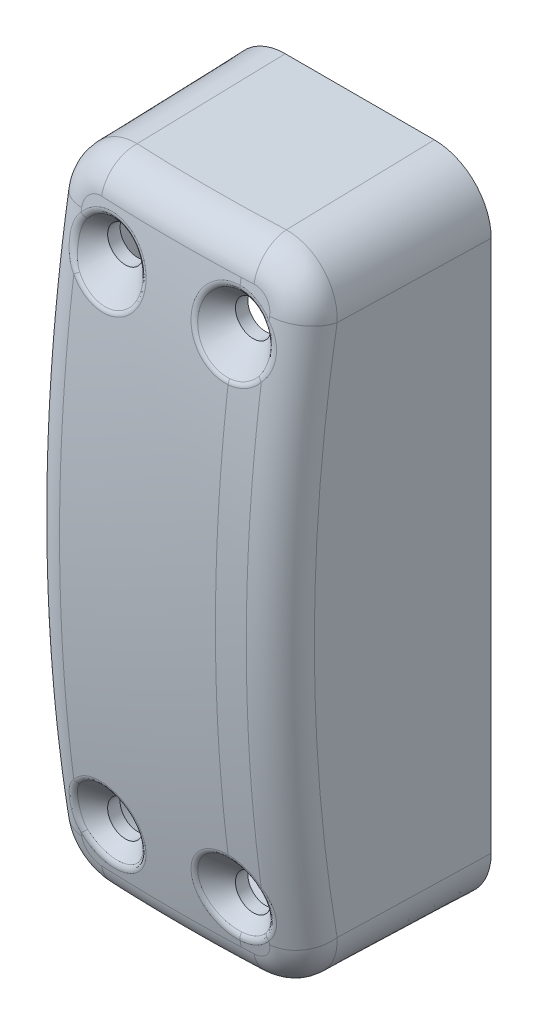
SolidWorks part; units mm, degrees
ref_plane "Plan de face" through (0, 0, 0) normal (0, 0, 1) x (1, 0, 0)
ref_plane "Plan de dessus" through (0, 0, 0) normal (0, 1, 0) x (1, 0, 0)
ref_plane "Plan de droite" through (0, 0, 0) normal (1, 0, 0) x (0, 0, -1)
sketch "Esquisse1" plane through (0, 0, 0) normal (0, 0, 1) x (1, 0, 0)
  line L0 (-18.5, 45.5) -> (18.5, -45.5) construction
  line L1 (-10.5, 45.5) -> (10.5, 45.5)
  line L2 (-18.5, 37.5) -> (-18.5, -37.5)
  line L3 (-10.5, -45.5) -> (10.5, -45.5)
  line L4 (18.5, 37.5) -> (18.5, -37.5)
  arc A0 (-18.5, -37.5) -> (-10.5, -45.5) centre (-10.5, -37.5) ccw
  arc A1 (10.5, -45.5) -> (18.5, -37.5) centre (10.5, -37.5) ccw
  arc A2 (10.5, 45.5) -> (18.5, 37.5) centre (10.5, 37.5) cw
  arc A3 (-10.5, 45.5) -> (-18.5, 37.5) centre (-10.5, 37.5) ccw
  dimension "D3" = 8
  dimension "D1" = 37
  dimension "D2" = 91
extrude "Boss.-Extru.1" add sketch "Esquisse1" along normal blind 35 draft 1.5
sketch "Esquisse2" plane through (0, 0, 0) normal (1, 0, 0) x (0, 0, -1)
  line L0 (0, 0) -> (-29.5, 0) construction
  line L2 (0, 45.5) -> (-25, 45.5) construction
  line L3 (0, -45.5) -> (-25, -45.5) construction
  line L4 (-17.0584, 75) -> (-37.1818, 75)
  line L5 (-37.1818, 75) -> (-37.1818, 0)
  line L6 (-37.1818, 0) -> (-29.5, 0)
  line L7 (0, 37.5) -> (0, -37.5) construction
  arc A0 (-25, 45.5) -> (-29.5, 0) centre (202.7778, 0) ccw
  arc A1 (-25, 45.5) -> (-17.0584, 75) centre (202.7778, 0) cw
  dimension "D4" = 29.5
  dimension "D1" = 25
  dimension "D2" = 7.6818
  dimension "D3" = 150
revolve "Enlèvement de matière-Révolution1" cut sketch "Esquisse2" angle 360 about L0
ref_plane "Plan1" through (0, 0, 28) normal (0, 0, -1) x (-1, 0, 0)
fillet "Congé3" radius 5 8 edges at (-15.0183, -43.2935, 24.935) (0, -44.8419, 25.1305) (16.2155, -42.1106, 25.0746) (17.7453, 0, 28.8212) (15.0183, 43.2935, 24.935) (0, 44.8419, 25.1305) (-16.2155, 42.1106, 25.0746) (-17.7453, 0, 28.8212)
ref_plane "Plan2" through (9, 0, 0) normal (1, 0, 0) x (0, 0, -1)
sketch "Esquisse4" plane through (9, 0, 0) normal (1, 0, 0) x (0, 0, -1)
  line L0 (-33.1168, 35) -> (9.8789, 35) construction
  dimension "D1" = 35
sketch "Esquisse5" plane through (9, 0, 0) normal (1, 0, 0) x (0, 0, -1)
  line L0 (0, 35) -> (-35.6546, 35) construction
  line L1 (0, -37.5) -> (0, 37.5) construction
  line L2 (-32.6299, 23.8768) -> (-24.0068, 32.5)
  line L3 (-24.0068, 32.5) -> (-24.0068, 35)
  line L4 (-24.0068, 35) -> (-32.6299, 35)
  line L6 (-32.6299, 35) -> (-32.6299, 23.8768)
  arc A0 (-25.7056, 40.8329) -> (-25.7056, -40.8329) centre (202.7778, 0) ccw construction
  arc A1 (-25.7056, 40.8329) -> (-25.7056, -40.8329) centre (202.7778, 0) ccw construction
  point P10 (-27.5068, 29)
  dimension "D1" = 35
  dimension "D2" = 45
  dimension "D3" = 5
  dimension "D4" = 12
  dimension "D5" = 8.6232
revolve "Enlèvement de matière-Révolution2" cut sketch "Esquisse5" angle 360 about L0
mirror "Symétrie1" about plane through (0, 0, 0) normal (1, 0, 0) of "Enlèvement de matière-Révolution2"
mirror "Symétrie2" about plane through (0, 0, 0) normal (0, 1, 0) of "Symétrie1", "Enlèvement de matière-Révolution2"
fillet "Congé4" radius 1 12 edges at (3.6366, -34.5233, 26.8913) (10.663, -39.1053, 25.9361) (10.9848, -29.4961, 27.3576) (3.6383, 33.8332, 26.9939) (10.7379, 29.3863, 27.3833) (10.8728, 39.0193, 25.9409) (-3.6275, -34.0736, 26.9586) (-3.6262, 34.1641, 26.9452) (13.8928, -34.8701, 26.4013) (-13.9161, -33.9427, 26.5353) (13.9161, 33.9427, 26.5353) (-13.8928, 34.8701, 26.4013)
shell "Coque1" thickness 1.75
sketch "Esquisse6" plane through (0, 0, 0) normal (0, 0, 1) x (1, 0, 0)
  circle A0 centre (-9, 35) radius 2.5 construction
  circle A1 centre (9, 35) radius 2.5 construction
  circle A2 centre (-9, -35) radius 2.5 construction
  circle A3 centre (9, -35) radius 2.5 construction
  circle A4 centre (-9, 35) radius 2.5
  circle A5 centre (9, 35) radius 2.5
  circle A6 centre (-9, -35) radius 2.5
  circle A7 centre (9, -35) radius 2.5
extrude "Enlèv. mat.-Extru.4" cut sketch "Esquisse6" along normal through all
sketch "Esquisse7" plane through (0, 0, 0) normal (1, 0, 0) x (0, 0, -1)
  line L1 (-17.5, 19) -> (-8.5, 19)
  line L2 (-17.5, 19) -> (-17.5, -19)
  line L3 (-17.5, -19) -> (-8.5, -19)
  line L4 (-8.5, 19) -> (-8.5, -19)
  line L5 (0, -37.5) -> (0, 37.5) construction
  dimension "D1" = 9
  dimension "D2" = 38
  dimension "D3" = 8.5
extrude "Enlèv. mat.-Extru.5" cut sketch "Esquisse7" against normal through all
